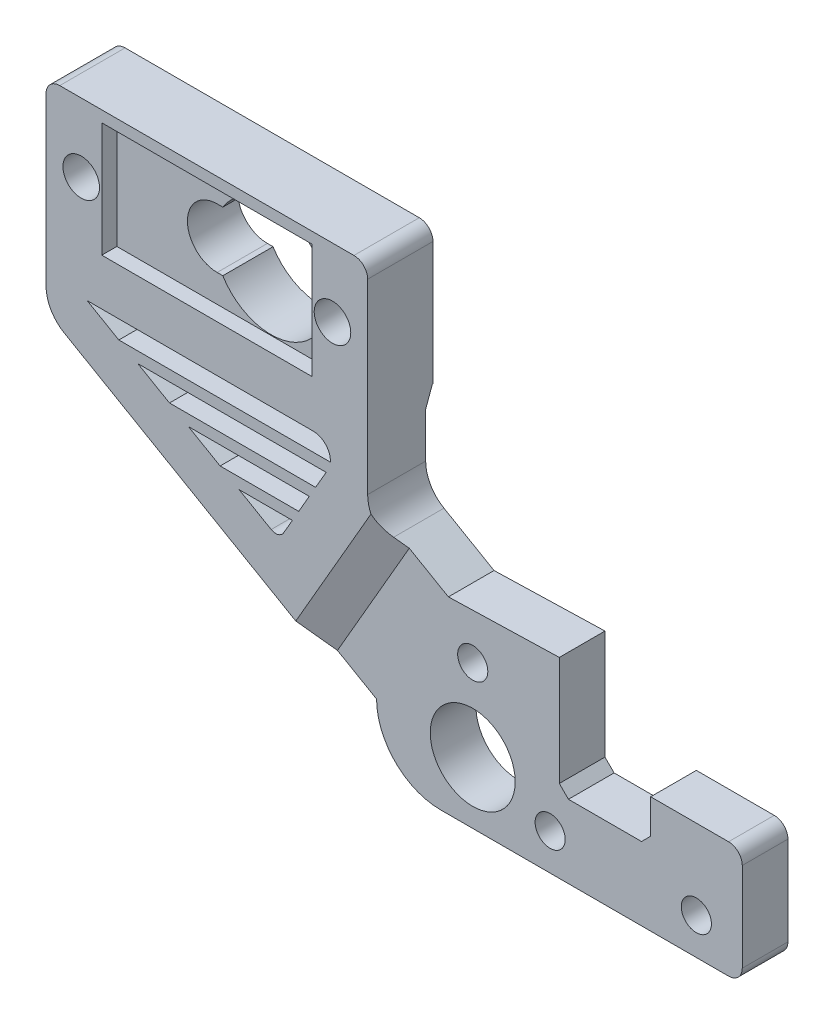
SolidWorks part; units mm, degrees
ref_plane "Спереди" through (0, 0, 0) normal (0, 0, 1) x (1, 0, 0)
ref_plane "Сверху" through (0, 0, 0) normal (0, 1, 0) x (1, 0, 0)
ref_plane "Справа" through (0, 0, 0) normal (1, 0, 0) x (0, 0, -1)
sketch "Эскиз1" plane through (0, 0, 0) normal (0, 0, 1) x (1, 0, 0)
  line L12 (-80.4981, -15.7) -> (-79.9981, -15.7)
  line L13 (-111.5243, -15.7) -> (-80.4981, -15.7)
  line L14 (-118.5243, 4.6993) -> (-118.5243, -8.7)
  line L15 (-98.5243, 5.2484) -> (-118.5243, 4.6993)
  line L16 (-98.5243, -6.7) -> (-98.5243, 5.2484)
  line L17 (-97.5243, -7.7) -> (-98.5243, -6.7)
  line L18 (-89.5243, -7.7) -> (-97.5243, -7.7)
  line L19 (-88.5243, -6.7) -> (-89.5243, -7.7)
  line L20 (-88.5243, -2.9603) -> (-88.5243, -6.7)
  line L21 (-80.4981, -2.9603) -> (-88.5243, -2.9603)
  line L22 (-79.9981, -2.9603) -> (-80.4981, -2.9603)
  line L23 (-78.4981, -14.2) -> (-78.4981, -4.4603)
  line L24 (-80.4981, -15.7) -> (-79.9981, -15.7)
  line L25 (-111.5243, -15.7) -> (-80.4981, -15.7)
  line L26 (-118.5243, 4.6993) -> (-118.5243, -8.7)
  line L27 (-98.5243, 5.2484) -> (-118.5243, 4.6993)
  line L28 (-98.5243, -6.7) -> (-98.5243, 5.2484)
  line L29 (-97.5243, -7.7) -> (-98.5243, -6.7)
  line L30 (-89.5243, -7.7) -> (-97.5243, -7.7)
  line L31 (-88.5243, -6.7) -> (-89.5243, -7.7)
  line L32 (-88.5243, -2.9603) -> (-88.5243, -6.7)
  line L33 (-80.4981, -2.9603) -> (-88.5243, -2.9603)
  line L34 (-79.9981, -2.9603) -> (-80.4981, -2.9603)
  line L35 (-78.4981, -14.2) -> (-78.4981, -4.4603)
  circle A1 centre (-99.5243, -11.7) radius 1.65
  circle A2 centre (-99.5243, -11.7) radius 1.65
  circle A3 centre (-108, 0) radius 1.65
  circle A4 centre (-108, 0) radius 1.65
  circle A5 centre (-108, -8.9603) radius 4.65
  circle A6 centre (-108, -8.9603) radius 4.65
  circle A7 centre (-83.5243, -11.7) radius 1.65
  circle A8 centre (-83.5243, -11.7) radius 1.65
  arc A9 (-118.5243, -8.7) -> (-111.5243, -15.7) centre (-111.5243, -8.7) ccw
  arc A10 (-78.4981, -4.4603) -> (-79.9981, -2.9603) centre (-79.9981, -4.4603) ccw
  arc A11 (-79.9981, -15.7) -> (-78.4981, -14.2) centre (-79.9981, -14.2) ccw
  arc A12 (-118.5243, -8.7) -> (-111.5243, -15.7) centre (-111.5243, -8.7) ccw
  arc A13 (-78.4981, -4.4603) -> (-79.9981, -2.9603) centre (-79.9981, -4.4603) ccw
  arc A14 (-79.9981, -15.7) -> (-78.4981, -14.2) centre (-79.9981, -14.2) ccw
  dimension "D1" = 0
  dimension "D2" = 0
  dimension "D3" = 0
  dimension "D4" = 0
  dimension "D5" = 0
extrude "Бобышка-Вытянуть1" add sketch "Эскиз1" along normal blind 5
sketch "Эскиз2" plane through (0, 0, 4.7) normal (0, 0, -1) x (-1, 0, 0)
  line L2 (130.3743, 25.9631) -> (118.1493, 25.9631) construction
  line L3 (118.1493, 33.4631) -> (153.3493, 33.4631)
  line L4 (135.6542, 22.7131) -> (136.2743, 22.7131)
  line L5 (136.2743, 29.2131) -> (135.6542, 29.2131)
  line L6 (135.6542, 22.7131) -> (136.2743, 22.7131)
  line L7 (136.2743, 29.2131) -> (135.6542, 29.2131)
  line L8 (118.1493, 33.4631) -> (118.1493, 18.4631)
  line L9 (118.1493, 18.4631) -> (153.3493, 18.4631)
  line L10 (153.3493, 33.4631) -> (153.3493, 18.4631)
  line L11 (119.6493, 26.6631) -> (119.6493, 31.4131) construction
  line L12 (151.8493, 31.4131) -> (151.8493, 26.6631) construction
  arc A8 (130.3743, 32.1631) -> (130.3743, 19.7631) centre (130.3743, 25.9631) ccw
  arc A9 (130.3743, 19.7631) -> (135.6542, 22.7131) centre (130.3743, 25.9631) ccw
  arc A10 (136.2743, 22.7131) -> (136.2743, 29.2131) centre (136.2743, 25.9631) ccw
  arc A11 (135.6542, 29.2131) -> (130.3743, 32.1631) centre (130.3743, 25.9631) ccw
  arc A12 (130.3743, 32.1631) -> (130.3743, 19.7631) centre (130.3743, 25.9631) ccw
  arc A13 (130.3743, 19.7631) -> (135.6542, 22.7131) centre (130.3743, 25.9631) ccw
  arc A14 (136.2743, 22.7131) -> (136.2743, 29.2131) centre (136.2743, 25.9631) ccw
  arc A15 (135.6542, 29.2131) -> (130.3743, 32.1631) centre (130.3743, 25.9631) ccw
  dimension "D2" = 1.5
  dimension "D3" = 15
  dimension "D4" = 1.5
  dimension "D1" = 0.3
extrude "Бобышка-Вытянуть2" add sketch "Эскиз2" along normal blind 5.5 separate body
sketch "Эскиз3" plane through (0, 0, 4.7) normal (0, 0, 1) x (1, 0, 0)
  line L0 (-147.0493, 31.7631) -> (-147.0493, 20.1631) construction
  line L1 (-147.2493, 32.2381) -> (-124.2493, 32.2381)
  line L2 (-147.2493, 32.2381) -> (-147.2493, 19.6881)
  line L3 (-147.2493, 19.6881) -> (-124.2493, 19.6881)
  line L4 (-118.1493, 18.4631) -> (-118.1493, 33.4631)
  line L5 (-118.1493, 33.4631) -> (-153.3493, 33.4631)
  line L6 (-153.3493, 33.4631) -> (-153.3493, 18.4631)
  line L7 (-153.3493, 18.4631) -> (-118.1493, 18.4631)
  line L8 (-118.1493, 18.4631) -> (-118.1493, 33.4631)
  line L9 (-118.1493, 33.4631) -> (-153.3493, 33.4631)
  line L10 (-153.3493, 33.4631) -> (-153.3493, 18.4631)
  line L11 (-153.3493, 18.4631) -> (-118.1493, 18.4631)
  line L12 (-124.2493, 32.2381) -> (-124.2493, 19.6881)
  line L13 (-124.7243, 32.0381) -> (-146.7743, 32.0381) construction
  line L14 (-124.4493, 31.7631) -> (-124.4493, 20.1631) construction
  line L15 (-124.7243, 19.8881) -> (-146.7743, 19.8881) construction
  dimension "D2" = 0.2
  dimension "D3" = 0.2
  dimension "D4" = 0.2
  dimension "D5" = 0.2
  dimension "D1" = 0
extrude "Бобышка-Вытянуть3" add sketch "Эскиз3" along normal up to surface (1.65 mm away)
sketch "Эскиз4" plane through (0, 0, 6.35) normal (0, 0, 1) x (1, 0, 0)
  circle A0 centre (-149.4993, 25.9631) radius 1.65
  circle A1 centre (-121.9993, 25.9631) radius 1.65
  point P0 (-121.9993, 25.9631)
  point P1 (-149.4993, 25.9631)
  dimension "D1" = 3.3
extrude "Вырез-Вытянуть1" cut sketch "Эскиз4" against normal up to surface (7.15 mm away)
sketch "Эскиз5" plane through (0, 0, 6.35) normal (0, 0, 1) x (1, 0, 0)
  circle A0 centre (-149.4993, 25.9631) radius 2
  circle A1 centre (-121.9993, 25.9631) radius 2
  dimension "D1" = 4
extrude "Вырез-Вытянуть2" cut sketch "Эскиз5" against normal blind 5
sketch "Эскиз6" plane through (0, 0, 5) normal (0, 0, 1) x (1, 0, 0)
  line L0 (-118.5243, -8.7) -> (-110.6636, 4.9151)
  line L2 (-118.5243, 4.6993) -> (-118.5243, -8.7) construction
  line L3 (-118.5243, -8.7) -> (-153.3493, 11.4062)
  line L4 (-153.3493, 11.4062) -> (-153.3493, 18.4631)
  line L5 (-118.5243, -8.7) -> (-118.5243, 4.6993) construction
  line L6 (-110.6636, 4.9151) -> (-118.1493, 9.237)
  line L7 (-118.1493, 9.237) -> (-118.1493, 18.4631)
  line L8 (-144, 4) -> (-93, 5.4) construction
  line L9 (-153.3493, 18.4631) -> (-118.1493, 18.4631)
  dimension "D1" = 30
  dimension "D2" = 60
extrude "Бобышка-Вытянуть4" add sketch "Эскиз6" along normal up to surface and the other way up to vertex
chamfer "Фаска1" distance 2 angle 20 1 edges at (-135.7493, 18.4631, 0)
chamfer "Фаска2" distance 8.65 angle 20 2 edges at (-114.5939, -1.8924, 5) (-114.5939, -1.8924, 6.35)
fillet "Скругление1" radius 1.5 2 edges at (-153.3493, 33.4631, 2.775) (-118.1493, 33.4631, 2.775)
fillet "Скругление2" radius 4 1 edges at (-153.3493, 11.4062, 3.175)
sketch "Эскиз7" plane through (0, 0, 6.35) normal (0, 0, 1) x (1, 0, 0)
  line L2 (-148.8493, 14.5816) -> (-124.1145, 14.5816)
  line L4 (-127.8455, 2.4551) -> (-122.4794, 11.7495)
  line L5 (-148.8493, 14.5816) -> (-127.8455, 2.4551)
  line L6 (-127.3455, 3.3212) -> (-122.4794, 11.7495)
  line L7 (-148.8493, 14.5816) -> (-128.7116, 2.9551)
  arc A2 (-124.1145, 14.5816) -> (-122.4794, 11.7495) centre (-124.1145, 12.6936) cw
  arc A3 (-127.3455, 3.3212) -> (-128.7116, 2.9551) centre (-128.2116, 3.8212) cw
  point P13 (-136.1984, 16.975)
  dimension "D2" = 1
  dimension "D1" = 5
extrude "Вырез-Вытянуть3" cut sketch "Эскиз7" against normal up to surface (6.35 mm away)
fillet "Скругление3" radius 4 1 edges at (-118.1493, 9.237, 3.1739)
sketch "Эскиз9" plane through (0, 0, 6.35) normal (0, 0, 1) x (1, 0, 0)
  line L0 (-145.3852, 12.5816) -> (-122.2298, 12.5816)
  line L1 (-148.8493, 14.5816) -> (-128.7116, 2.9551) construction
  line L2 (-143.3067, 11.3816) -> (-122.6918, 11.3816)
  line L3 (-139.8426, 9.3816) -> (-123.8465, 9.3816)
  line L4 (-127.3455, 3.3212) -> (-122.4794, 11.7495) construction
  line L5 (-137.7642, 8.1816) -> (-124.5393, 8.1816)
  line L6 (-134.3001, 6.1816) -> (-125.694, 6.1816)
  line L7 (-132.2216, 4.9816) -> (-126.3868, 4.9816)
  line L9 (-124.1145, 14.5816) -> (-148.8493, 14.5816) construction
  line L10 (-145.3852, 12.5816) -> (-143.3067, 11.3816)
  line L11 (-122.2298, 12.5816) -> (-122.2298, 11.3816)
  line L12 (-122.2298, 11.3816) -> (-122.6918, 11.3816)
  line L13 (-139.8426, 9.3816) -> (-137.7642, 8.1816)
  line L14 (-123.8465, 9.3816) -> (-124.5393, 8.1816)
  line L15 (-125.694, 6.1816) -> (-126.3868, 4.9816)
  line L16 (-134.3001, 6.1816) -> (-132.2216, 4.9816)
  arc A0 (-122.4794, 11.7495) -> (-124.1145, 14.5816) centre (-124.1145, 12.6936) ccw construction
  dimension "D1" = 2
  dimension "D2" = 1.2
  dimension "D3" = 2
  dimension "D4" = 1.2
  dimension "D5" = 2
  dimension "D6" = 1.2
extrude "Бобышка-Вытянуть5" add sketch "Эскиз9" against normal up to surface (6.35 mm away)
equation "\"0ю2\"=0.145485"
equation "\"1ю5\"=2"
